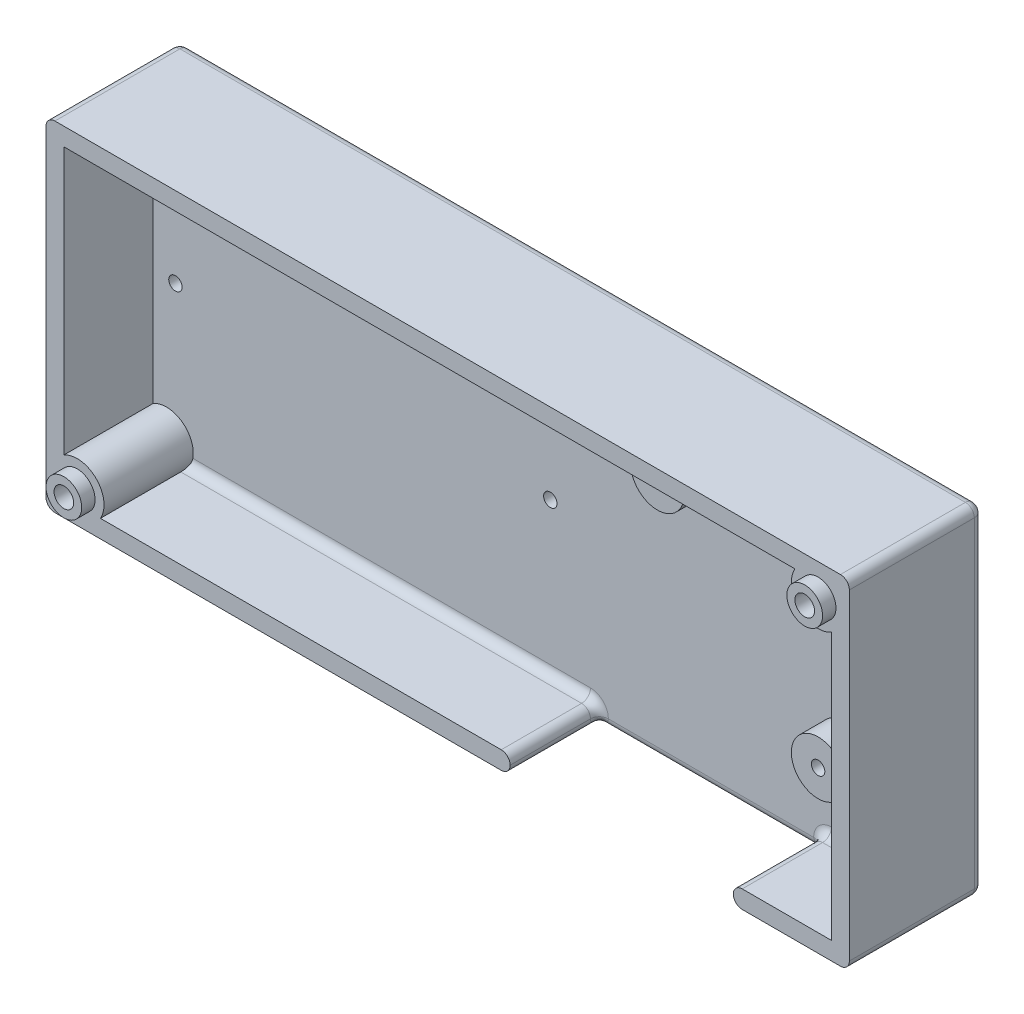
SolidWorks part; units mm, degrees
ref_plane "Ebene vorne" through (0, 0, 0) normal (0, 0, 1) x (1, 0, 0)
ref_plane "Ebene oben" through (0, 0, 0) normal (0, 1, 0) x (1, 0, 0)
ref_plane "Ebene rechts" through (0, 0, 0) normal (1, 0, 0) x (0, 0, -1)
sketch "Skizze1" plane through (0, 0, 0) normal (0, 0, 1) x (1, 0, 0)
  line L1 (45, -19) -> (-45, -19)
  line L2 (45, -19) -> (45, 19)
  line L3 (45, 19) -> (-45, 19)
  line L4 (-45, -19) -> (-45, 19)
  line L5 (45, -19) -> (-45, 19) construction
  line L6 (45, 19) -> (-45, -19) construction
  point P0 (0, 0)
  dimension "D1" = 90
  dimension "D2" = 38
extrude "Aufsatz-Linear austragen1" add sketch "Skizze1" along normal blind 5
sketch "Skizze2" plane through (0, 0, 5) normal (0, 0, 1) x (1, 0, 0)
  line L4 (43, 17) -> (-43, 17)
  line L5 (-43, 17) -> (-43, -17)
  line L6 (-43, -17) -> (43, -17)
  line L7 (43, -17) -> (43, 17)
  line L8 (-45, 19) -> (-45, -19)
  line L9 (-45, -19) -> (45, -19)
  line L10 (45, -19) -> (45, 19)
  line L11 (45, 19) -> (-45, 19)
  line L12 (-45, 19) -> (-45, -19)
  line L13 (-45, -19) -> (45, -19)
  line L14 (45, -19) -> (45, 19)
  line L15 (45, 19) -> (-45, 19)
  dimension "D1" = 0
  dimension "D2" = 2
extrude "Aufsatz-Linear austragen2" add sketch "Skizze2" along normal blind 10
sketch "Skizze3" plane through (0, 0, 5) normal (0, 0, 1) x (1, 0, 0)
  circle A0 centre (16.5, 11) radius 3
  circle A1 centre (34.5, -8) radius 3
  dimension "D1" = 6
  dimension "D2" = 6
  dimension "D3" = 34.5
  dimension "D4" = 16.5
  dimension "D5" = 19
  dimension "D6" = 11
extrude "Aufsatz-Linear austragen3" add sketch "Skizze3" along normal blind 3
sketch "Skizze4" plane through (0, 0, 8) normal (0, 0, 1) x (1, 0, 0)
  circle A0 centre (16.5, 11) radius 0.75
  circle A1 centre (34.5, -8) radius 0.75
  dimension "D1" = 1.5
  dimension "D2" = 1.5
extrude "Schnitt-Linear austragen1" cut sketch "Skizze4" against normal blind 3
sketch "Skizze5" plane through (0, 0, 5) normal (0, 0, 1) x (1, 0, 0)
  circle A0 centre (1.5, 0) radius 0.75
  circle A1 centre (-40.5, 0) radius 0.75
  dimension "D1" = 42
  dimension "D2" = 1.5
extrude "Schnitt-Linear austragen2" cut sketch "Skizze5" against normal blind 3
sketch "Skizze6" plane through (0, 0, 5) normal (0, 0, 1) x (1, 0, 0)
  line L3 (-43, -17) -> (43, -17) construction
  line L4 (-43, 17) -> (-43, -17) construction
  line L5 (43, -17) -> (43, 17) construction
  line L6 (43, 17) -> (-43, 17) construction
  circle A0 centre (-41.5, -15.5) radius 3
  circle A1 centre (41.5, 15.5) radius 3
  dimension "D1" = 6
  dimension "D4" = 6
  dimension "D2" = 1.5
  dimension "D3" = 1.5
  dimension "D5" = 1.5
  dimension "D6" = 1.5
extrude "Aufsatz-Linear austragen4" add sketch "Skizze6" along normal up to surface (10 mm away)
sketch "Skizze8" plane through (0, 0, 15) normal (0, 0, 1) x (1, 0, 0)
  circle A0 centre (-41.5, -15.5) radius 2
  circle A1 centre (-41.5, -15.5) radius 1.1
  dimension "D1" = 4
  dimension "D2" = 2.2
extrude "Aufsatz-Linear austragen5" add sketch "Skizze8" along normal blind 1.5
sketch "Skizze10" plane through (0, 0, 15) normal (0, 0, 1) x (1, 0, 0)
  circle A0 centre (-41.5, -15.5) radius 1.1
extrude "Schnitt-Linear austragen4" cut sketch "Skizze10" against normal blind 21.5
sketch "Skizze11" plane through (0, 0, 15) normal (0, 0, 1) x (1, 0, 0)
  circle A0 centre (41.5, 15.5) radius 2
  circle A1 centre (41.5, 15.5) radius 1.1
  dimension "D1" = 4
  dimension "D2" = 2.2
extrude "Aufsatz-Linear austragen6" add sketch "Skizze11" along normal blind 1.5
sketch "Skizze12" plane through (0, 0, 15) normal (0, 0, 1) x (1, 0, 0)
  circle A0 centre (41.5, 15.5) radius 1.1
extrude "Schnitt-Linear austragen6" cut sketch "Skizze12" against normal blind 21.5
sketch "Skizze13" plane through (0, -19, 0) normal (0, -1, 0) x (1, 0, 0)
  line L0 (-45, 15) -> (45, 15) construction
  line L1 (7, 15) -> (32, 15)
  line L2 (7, 15) -> (7, 5)
  line L3 (7, 5) -> (32, 5)
  line L4 (32, 15) -> (32, 5)
  dimension "D1" = 25
  dimension "D2" = 10
  dimension "D3" = 7
extrude "Schnitt-Linear austragen7" cut sketch "Skizze13" against normal blind 2
fillet "Verrundung1" radius 1 13 edges at (32, -17, 10) (32, -19, 10) (19.5, -19, 5) (7, -17, 10) (7, -19, 10) (45, -19, 7.5) (45, 0, 0) (45, 19, 7.5) (0, 19, 0) (-45, 19, 7.5) (-45, 0, 0) (-45, -19, 7.5) (0, -19, 0)
fillet "Verrundung2" radius 1 8 edges at (32.2929, -18.7071, 4.7071) (32.2929, -17.2929, 5) (6.7071, -18.7071, 4.7071) (6.7071, -17.2929, 5) (43, -2.049, 5) (38, -17, 5) (-2.049, 17, 5) (-16.451, -17, 5)
